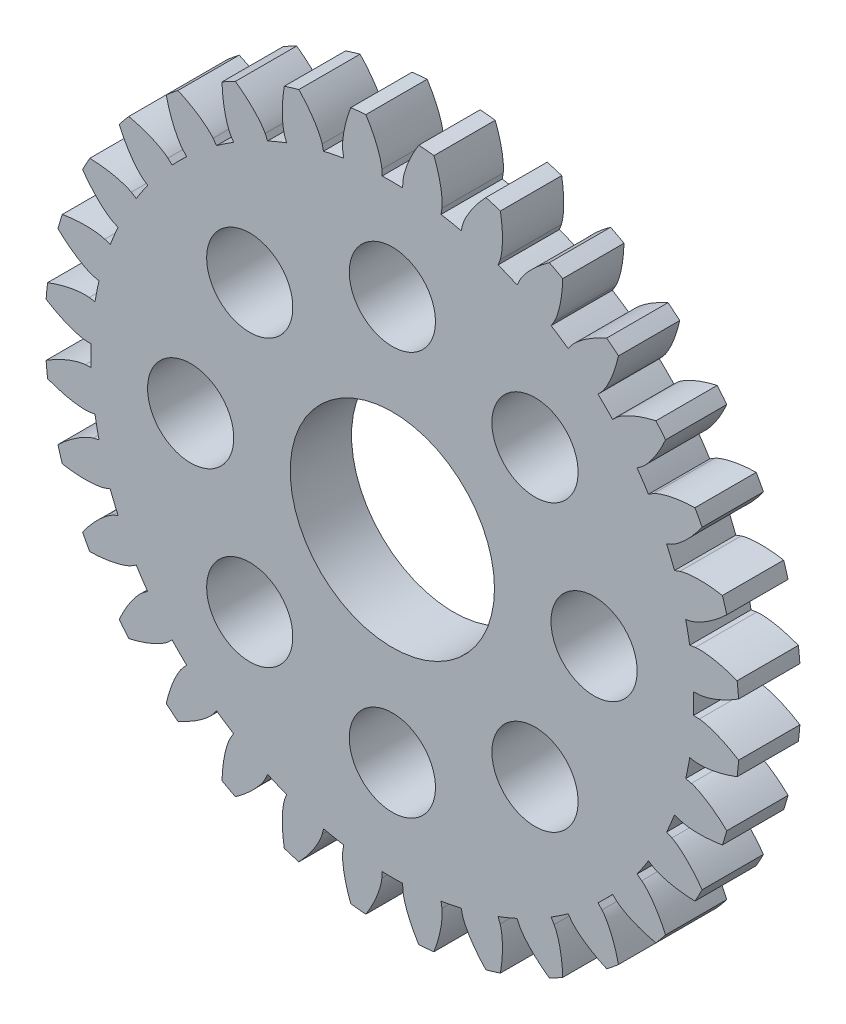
SolidWorks part; units mm, degrees
ref_plane "正面" through (0, 0, 0) normal (0, 0, 1) x (1, 0, 0)
ref_plane "平面" through (0, 0, 0) normal (0, 1, 0) x (1, 0, 0)
ref_plane "右側面" through (0, 0, 0) normal (1, 0, 0) x (0, 0, -1)
sketch "インボリュート スケッチ" plane through (0, 0, 0) normal (0, 0, 1) x (1, 0, 0)
  line L0 (-46.6927, -16.6405) -> (0.5138, -15.0263)
  line L1 (0.5138, -15.0263) -> (-0.5138, 15.0263) construction
  line L2 (0, 0) -> (0, 17) construction
  line L3 (-0.5138, 15.0263) -> (-0.5041, 14.7414)
  line L4 (0, 0) -> (0.5138, -15.0263)
  line L5 (-0.5041, 14.7414) -> (0, 14.7414)
  line L6 (0, 14.7414) -> (0, 0)
  circle A0 centre (0, 0) radius 15.0351 construction
  circle A1 centre (0, 0) radius 16 construction
  circle A2 centre (0, 0) radius 14.75 construction
  circle A3 centre (0, 0) radius 17 construction
  spline S0 degree 4 poles (-0.5138, 15.0263) (-0.5159, 15.0548) (-0.5218, 15.1117) (-0.5404, 15.2246) (-0.5892, 15.4367) (-0.6759, 15.716) (-0.8805, 16.2317) (-1.297, 17.0096) (-1.9931, 17.9739) (-3.1489, 19.1678) (-4.6974, 20.3489) (-6.5672, 21.3886) (-8.717, 22.22) (-10.9518, 22.779) (-13.2347, 23.082) (-15.65, 23.1478) (-18.6332, 22.9171) (-22.1316, 22.1876) (-26.0306, 20.7553) (-30.0637, 18.5141) (-33.7308, 15.7177) (-36.579, 12.8613) (-38.7428, 10.1707) (-40.3547, 7.7903) (-41.5274, 5.812) (-42.8455, 3.2575) (-43.965, 0.6074) (-44.8848, -2.1174) (-45.7495, -5.4571) (-46.2198, -8.0013) (-46.5006, -10.2863) (-46.6451, -12.2894) (-46.6919, -13.3002) (-46.7148, -14.1491) (-46.7213, -14.9318) (-46.7204, -15.5377) (-46.7026, -16.4013) (-46.6795, -17.0436) (-46.6261, -18.1011) (-46.5621, -18.9123) (-46.474, -19.9053) (-46.372, -20.7834) (-46.25, -21.7319) (-46.1122, -22.627) (-45.9948, -23.3298) (-45.9116, -23.7755) (-45.8682, -24.0076) knots 0 0 0 0 0 0.001401 0.002802 0.005604 0.010661 0.015718 0.02996 0.048734 0.068727 0.096889 0.125051 0.153212 0.181374 0.209535 0.237696 0.271429 0.327752 0.384075 0.440398 0.496721 0.553044 0.581206 0.609367 0.637529 0.66569 0.722013 0.750174 0.778336 0.834659 0.84874 0.86282 0.876901 0.883942 0.890982 0.900036 0.909091 0.920455 0.931818 0.943182 0.954545 0.965909 0.977273 0.988636 1 1 1 1 1 construction
  spline S1 degree 4 poles (-0.5138, 15.0263) (-0.5159, 15.0548) (-0.5218, 15.1117) (-0.5404, 15.2246) (-0.5892, 15.4367) (-0.6759, 15.716) (-0.8805, 16.2317) (-1.297, 17.0096) (-1.9931, 17.9739) (-3.1489, 19.1678) (-4.6974, 20.3489) (-6.5672, 21.3886) (-8.717, 22.22) (-10.9518, 22.779) (-13.2347, 23.082) (-15.65, 23.1478) (-18.6332, 22.9171) (-22.1316, 22.1876) (-26.0306, 20.7553) (-30.0637, 18.5141) (-33.7308, 15.7177) (-36.579, 12.8613) (-38.7428, 10.1707) (-40.3547, 7.7903) (-41.5274, 5.812) (-42.8455, 3.2575) (-43.965, 0.6074) (-44.8848, -2.1174) (-45.7495, -5.4571) (-46.2198, -8.0013) (-46.5006, -10.2863) (-46.6451, -12.2894) (-46.6919, -13.3002) (-46.7148, -14.1491) (-46.7213, -14.9318) (-46.7204, -15.5377) (-46.7081, -16.1325) (-46.6984, -16.4727) (-46.6927, -16.6405) knots 0 0 0 0 0 0.001401 0.002802 0.005604 0.010661 0.015718 0.02996 0.048734 0.068727 0.096889 0.125051 0.153212 0.181374 0.209535 0.237696 0.271429 0.327752 0.384075 0.440398 0.496721 0.553044 0.581206 0.609367 0.637529 0.66569 0.722013 0.750174 0.778336 0.834659 0.84874 0.86282 0.876901 0.883942 0.890982 0.900036 0.909091 0.909091 0.909091 0.909091 0.909091
  point P6 (-0.7851, 15.9807)
  point P12 (0, 16)
  point P24 (0, 0)
extrude "インボリュート ボス" add sketch "インボリュート スケッチ" along normal blind 3
mirror "インボリュート ミラー" about plane through (0, 0, 3) normal (1, 0, 0)
sketch "歯先円 スケッチ" plane through (0, 0, 3) normal (0, 0, 1) x (1, 0, 0)
  circle A0 centre (0, 0) radius 49.5693
  circle A1 centre (0, 0) radius 17
extrude "歯先円 カット" cut sketch "歯先円 スケッチ" against normal through all
sketch "歯分割 スケッチ" plane through (0, 0, 3) normal (0, 0, 1) x (1, 0, 0)
  line L0 (-1.6663, 16.9181) -> (0, 0)
  line L1 (0, 0) -> (1.6663, 16.9181)
  line L2 (0, 0) -> (0, 16) construction
  arc A0 (-1.6663, 16.9181) -> (1.6663, 16.9181) centre (0, 0) ccw
  circle A2 centre (0, 0) radius 16 construction
  arc A3 (-1.2962, 16.9505) -> (-7.4154, -15.2974) centre (0, 0) ccw construction
  point P9 (-1.5683, 15.923)
  point P10 (1.5683, 15.923)
extrude "歯分割 カット" cut sketch "歯分割 スケッチ" against normal through all
pattern_circular "歯分割 円形コピー" count 32 over 360 about axis through (0, 0, 0) along (0, 0, 1)
sketch "歯底円 スケッチ" plane through (0, 0, 3) normal (0, 0, 1) x (1, 0, 0)
  circle A0 centre (0, 0) radius 14.75
extrude "歯底円 ボス" add sketch "歯底円 スケッチ" against normal through all
sketch "軸 丸穴 スケッチ" plane through (0, 0, 3) normal (0, 0, 1) x (1, 0, 0)
  circle A0 centre (0, 0) radius 5
  dimension "D1" = 10
extrude "軸 丸穴 カット" cut sketch "軸 丸穴 スケッチ" against normal through all
sketch "軸 キー溝 スケッチ" plane through (0, 0, 3) normal (0, 0, 1) x (1, 0, 0)
  line L2 (-1.5, 3.7081) -> (-1.5, 5.4)
  line L3 (-1.5, 5.4) -> (1.5, 5.4)
  line L4 (1.5, 3.7081) -> (1.5, 5.4)
  arc A0 (-1.5, 3.7081) -> (1.5, 3.7081) centre (0, 0) ccw
  dimension "D1" = 8
  dimension "D2" = 3
  dimension "D3" = 5.4
extrude "軸 キー溝 カット" [suppressed] cut sketch "軸 キー溝 スケッチ" against normal through all
sketch "軸 Dカット スケッチ" plane through (0, 0, 3) normal (0, 0, 1) x (1, 0, 0)
  line L0 (-2.3958, 3) -> (2.3958, 3)
  arc A0 (-2.828, 2.8289) -> (2.828, 2.8289) centre (0, 0) ccw
  arc A1 (-2.3958, 3) -> (-2.828, 2.8289) centre (-2.6458, 3) ccw
  arc A2 (2.828, 2.8289) -> (2.3958, 3) centre (2.6458, 3) ccw
  dimension "D1" = 8
  dimension "D3" = 0.5
  dimension "D2" = 3
extrude "軸 Dカット カット" [suppressed] cut sketch "軸 Dカット スケッチ" against normal through all
sketch "軸 角穴 スケッチ" plane through (0, 0, 3) normal (0, 0, 1) x (1, 0, 0)
  line L0 (-5.1, 5.1) -> (5.1, 5.1)
  line L1 (-5, -5) -> (5, -5) construction
  line L2 (-5, -5) -> (-5, 5) construction
  line L3 (-5, 5) -> (5, 5) construction
  line L4 (5, -5) -> (5, 5) construction
  line L5 (-5, -5) -> (5, 5) construction
  line L6 (-5, 5) -> (5, -5) construction
  line L7 (5.1, -5.1) -> (5.1, 5.1)
  line L8 (-5.1, -5.1) -> (5.1, -5.1)
  line L9 (-5.1, -5.1) -> (-5.1, 5.1)
  point P0 (0, 0)
  dimension "D1" = 10
  dimension "D2" = 0.1
extrude "軸 角穴 カット" [suppressed] cut sketch "軸 角穴 スケッチ" against normal through all
sketch "フランジ穴 スケッチ" plane through (0, 0, 3) normal (0, 0, 1) x (1, 0, 0)
  circle A0 centre (0, 12) radius 1.6
  circle A1 centre (12, 0) radius 1.6
  circle A2 centre (0, -12) radius 1.6
  circle A3 centre (-12, 0) radius 1.6
  point P12 (0, 0)
  dimension "D2" = 3.2
  dimension "D3" = 12
  dimension "D1" = 4
extrude "フランジ穴 カット" [suppressed] cut sketch "フランジ穴 スケッチ" against normal through all
sketch "合致用スケッチ" plane through (0, 0, 3) normal (0, 0, 1) x (1, 0, 0)
  line L0 (0, 0) -> (0, 16)
  line L1 (0, 0) -> (1.5683, 15.923)
  circle A2 centre (0, 0) radius 16
sketch "ｽｹｯﾁ2" plane through (0, 0, 0) normal (0, 0, -1) x (-1, 0, 0)
  line L0 (0, -5) -> (0, -14.75) construction
  line L1 (-3.5355, -3.5355) -> (-10.4298, -10.4298) construction
  line L2 (-5, 0) -> (-14.75, 0) construction
  line L3 (-3.5355, 3.5355) -> (-10.4298, 10.4298) construction
  line L4 (0, 5) -> (0, 14.75) construction
  line L5 (3.5355, 3.5355) -> (10.4298, 10.4298) construction
  line L6 (5, 0) -> (14.75, 0) construction
  line L7 (3.5355, -3.5355) -> (10.4298, -10.4298) construction
  circle A0 centre (0, 0) radius 5 construction
  arc A1 (-0.5041, -14.7414) -> (0.5041, -14.7414) centre (0, 0) ccw construction
  circle A2 centre (0, -9.875) radius 2.1098
  circle A3 centre (-6.9827, -6.9827) radius 2.1098
  circle A4 centre (-9.875, 0) radius 2.1098
  circle A5 centre (-6.9827, 6.9827) radius 2.1098
  circle A6 centre (0, 9.875) radius 2.1098
  circle A7 centre (6.9827, 6.9827) radius 2.1098
  circle A8 centre (9.875, 0) radius 2.1098
  circle A9 centre (6.9827, -6.9827) radius 2.1098
  point P9 (-6.5769, -0.6608)
  point P10 (0, 0)
  point P40 (0, 0)
  dimension "D1" = 4.2195
  dimension "D2" = 8
extrude "ｶｯﾄ - 押し出し1" cut sketch "ｽｹｯﾁ2" against normal through all
equation "\"モジュール\"= 1"
equation "\"基準圧力角\"= 20"
equation "\"歯数\"= 32"
equation "\"基準円直径\"= \"歯数\" * \"モジュール\""
equation "\"基礎円直径\"= \"基準円直径\" * cos ( \"基準圧力角\" )"
equation "\"歯先円直径\"= \"基準円直径\" + 2 * \"モジュール\""
equation "\"歯底円直径\"= \"基準円直径\" - 2.5 * \"モジュール\""
equation "\"D1@インボリュート スケッチ\" = \"基礎円直径\""
equation "\"D2@インボリュート スケッチ\" = \"基準円直径\""
equation "\"D3@インボリュート スケッチ\" = \"歯底円直径\""
equation "\"D4@インボリュート スケッチ\" = \"歯先円直径\""
equation "\"D5@インボリュート スケッチ\" = Pi * \"モジュール\" / 4"
equation "\"D1@歯先円 スケッチ\" = \"歯先円直径\""
equation "\"D1@歯分割 スケッチ\" = \"基準円直径\""
equation "\"D2@歯分割 スケッチ\" = PI * \"モジュール\""
equation "\"D1@歯分割 円形コピー\" = \"歯数\""
equation "\"D1@歯底円 スケッチ\" = \"歯底円直径\""
equation "\"板厚\"= 3"
equation "\"D1@インボリュート ボス\"=\"板厚\""
equation "\"D1@合致用スケッチ\" = \"基準円直径\""
equation "\"D2@合致用スケッチ\"=180/\"歯数\""
